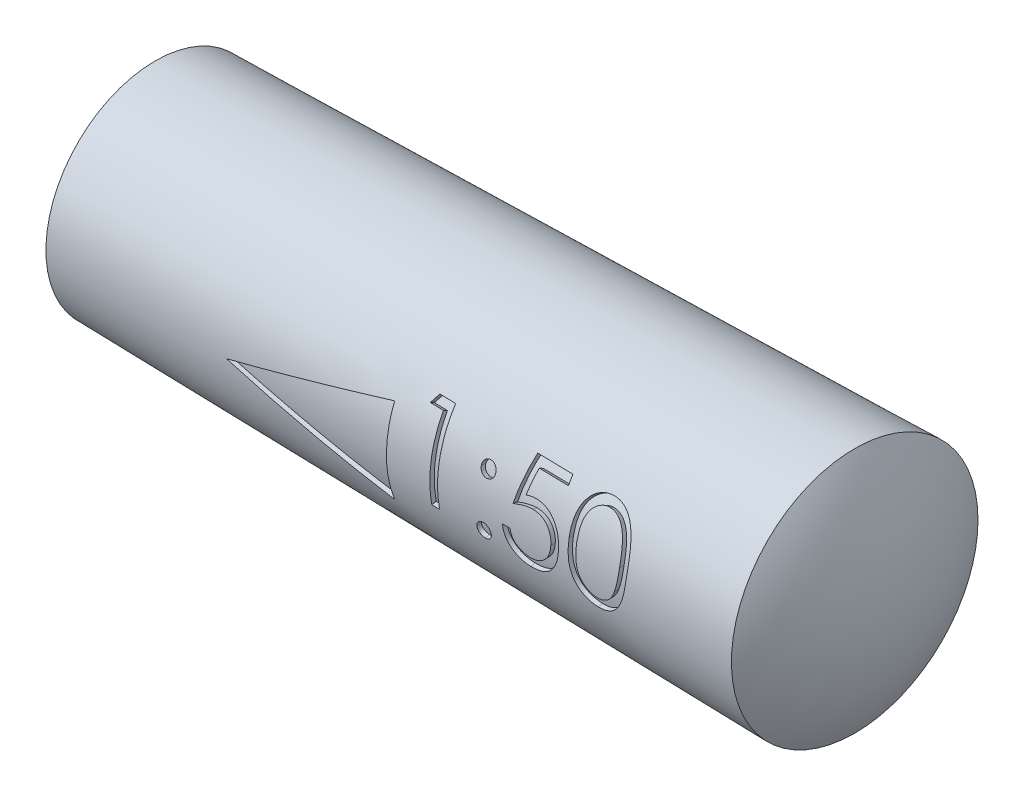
SolidWorks part; units mm, degrees
ref_plane "Front Plane" through (0, 0, 0) normal (0, 0, 1) x (1, 0, 0)
ref_plane "Top Plane" through (0, 0, 0) normal (0, 1, 0) x (1, 0, 0)
ref_plane "Right Plane" through (0, 0, 0) normal (1, 0, 0) x (0, 0, -1)
sketch "Sketch1" plane through (0, 0, 0) normal (1, 0, 0) x (0, 0, -1)
  circle A0 centre (0, 0) radius 1.25
  dimension "D1" = 2.5
extrude "Extrude1" add sketch "Sketch1" along normal mid plane 8
draft "Draft1" type of draft neutral plane draft angle 1.146 faces to draft 1 parameters "D1"=1.146
sketch "Sketch2" plane through (0, 0, 0) normal (0, 0, 1) x (1, 0, 0)
  line L0 (-4, 0) -> (-4, 1.25)
  line L1 (-4, 1.25) -> (-4, -1.25) construction
  line L2 (-4, 0) -> (-4.4, 0)
  line L3 (-4.4, 0) -> (-4.4, -1.33) construction
  line L4 (4, 0) -> (4, 1.41)
  line L5 (4, -1.41) -> (4, 1.41) construction
  line L6 (4, 0) -> (4.4, 0)
  line L7 (4.4, 0) -> (4.4, -1.33) construction
  line L8 (-4, -1.25) -> (4, -1.41) construction
  arc A0 (-4.4, 0) -> (-4, 1.25) centre (-2.2469, 0) cw
  arc A1 (4.4, 0) -> (4, 1.41) centre (1.7149, 0) ccw
  point P14 (0, -1.33)
revolve "Revolve1" add sketch "Sketch2" angle 360 about L2
sketch "Sketch5" plane through (0, 0, 0) normal (0, 0, 1) x (1, 0, 0)
  line L0 (0, 1.33) -> (0, -1.33) construction
  line L1 (4, 1.41) -> (-4, 1.25) construction
  line L2 (-4, -1.25) -> (4, -1.41) construction
ref_plane "Plane2" through (0, 0, 0) normal (-0.02, 0, 0.9998) x (0.9998, 0, 0.02)
sketch "Sketch6" plane through (0, 0, 0) normal (-0.02, 0, 0.9998) x (0.9998, 0, 0.02)
  line L0 (0, 0) -> (0, 0.5)
  line L1 (0, 1.33) -> (0, -1.33) construction
  line L2 (0, 0.5) -> (-1.866, 0)
  line L3 (-1.866, 0) -> (0, -0.5)
  line L4 (0, -0.5) -> (0, 0)
  line L5 (0, -0.25) -> (3, -0.25) construction
  text T0 "1:50" font "Century Gothic" height 1
  dimension "D1" = 1
  dimension "D2" = 30
  dimension "D3" = 3
wrap "Wrap2" sketch "Sketch6" wrap type deboss source sketch "Sketch6" thickness 0.05 parameters "D1"=0.05
equation "\"D2@Sketch2\" = \"D1@Sketch2\""
